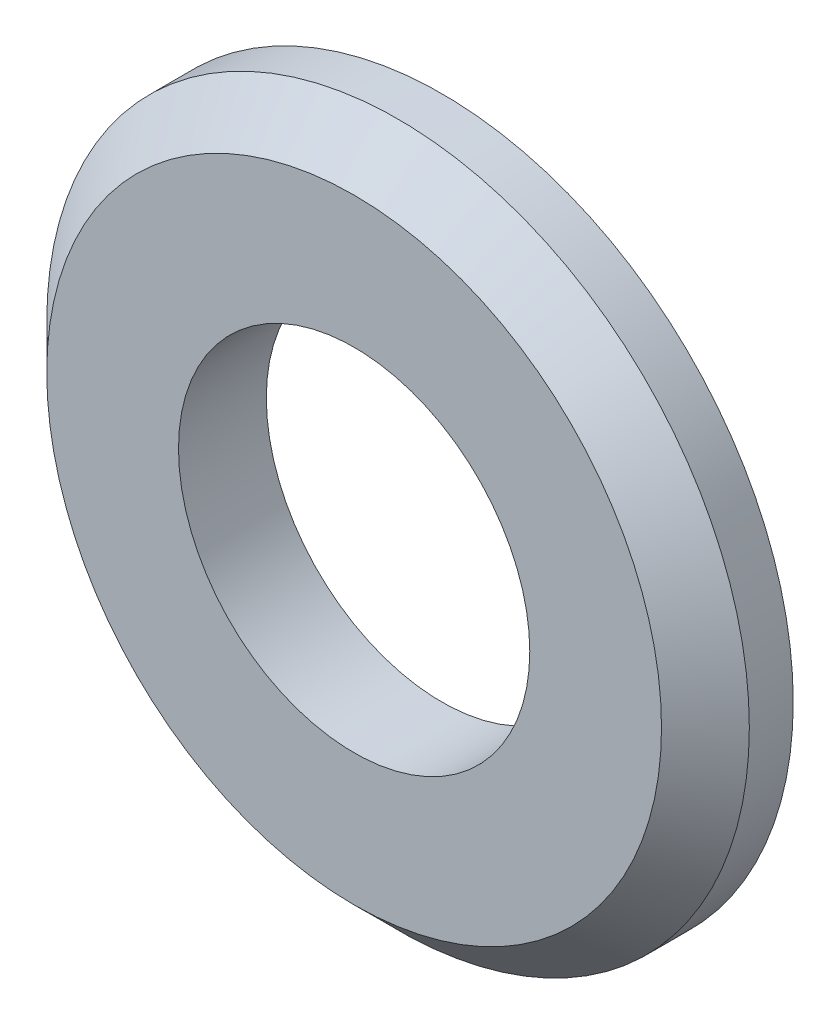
SolidWorks part; units mm, degrees
ref_plane "Plan de face" through (0, 0, 0) normal (0, 0, 1) x (1, 0, 0)
ref_plane "Plan de dessus" through (0, 0, 0) normal (0, 1, 0) x (1, 0, 0)
ref_plane "Plan de droite" through (0, 0, 0) normal (1, 0, 0) x (0, 0, -1)
sketch "Esquisse2" plane through (0, 0, 0) normal (0, 0, 1) x (1, 0, 0)
  circle A0 centre (0, 0) radius 4
  circle A1 centre (0, 0) radius 2
  dimension "D1" = 4
  dimension "D2" = 8
extrude "Boss.-Extru.1" add sketch "Esquisse2" along normal blind 1
chamfer "Chanfrein1" distance 0.5 angle 45 1 edges at (4, 0, 1)
